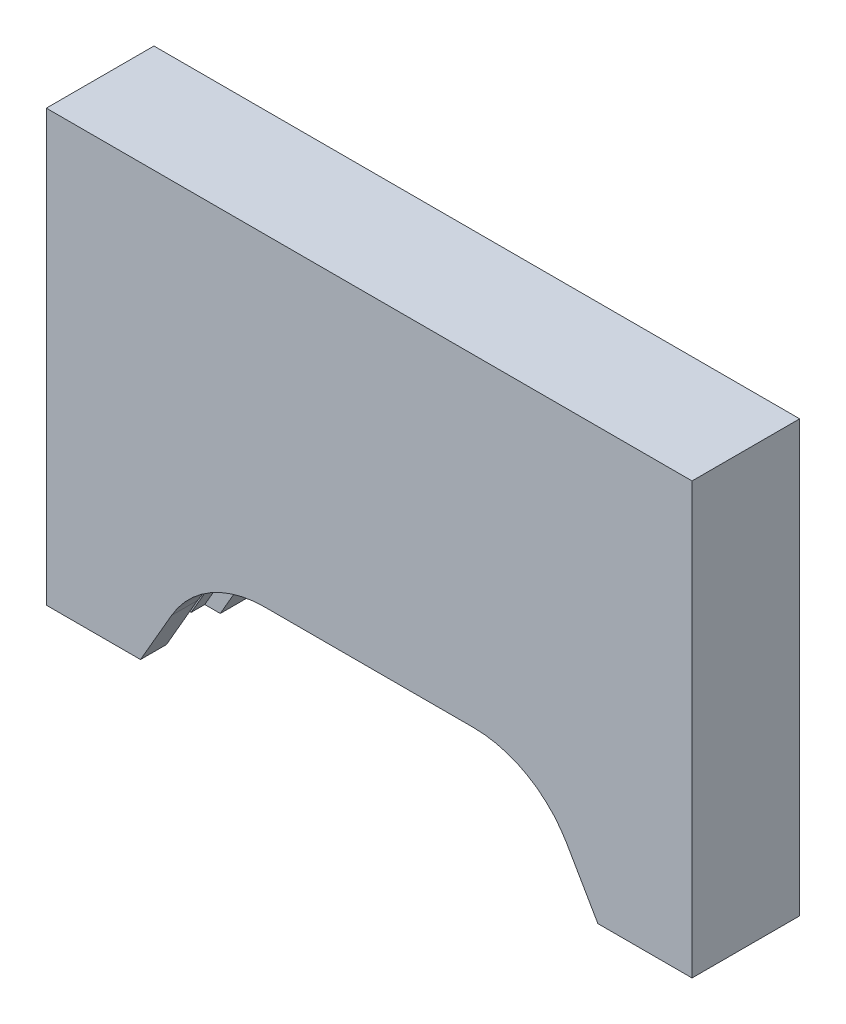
SolidWorks part; units mm, degrees
ref_plane "Front Plane" through (0, 0, 0) normal (0, 0, 1) x (1, 0, 0)
ref_plane "Top Plane" through (0, 0, 0) normal (0, 1, 0) x (1, 0, 0)
ref_plane "Right Plane" through (0, 0, 0) normal (1, 0, 0) x (0, 0, -1)
sketch "Sketch1" plane through (0, 0, 0) normal (0, 0, 1) x (1, 0, 0)
  line L1 (-76.2, -50.8) -> (76.2, -50.8)
  line L2 (-76.2, -50.8) -> (-76.2, 50.8)
  line L3 (-76.2, 50.8) -> (76.2, 50.8)
  line L4 (76.2, -50.8) -> (76.2, 50.8)
  line L5 (-76.2, -50.8) -> (76.2, 50.8) construction
  line L6 (-76.2, 50.8) -> (76.2, -50.8) construction
  point P0 (0, 0)
  dimension "D1" = 152.4
  dimension "D2" = 101.6
extrude "Boss-Extrude1" add sketch "Sketch1" along normal blind 25.4
sketch "Sketch3" plane through (0, 0, 25.4) normal (0, 0, 1) x (1, 0, 0)
  line L0 (-53.975, -50.8) -> (-46.6427, -38.1)
  line L1 (-24.6456, -25.4) -> (24.6456, -25.4)
  line L2 (46.6427, -38.1) -> (53.975, -50.8)
  line L3 (-76.2, -50.8) -> (76.2, -50.8) construction
  line L5 (0, -50.8) -> (0, 50.8) construction
  line L6 (76.2, 50.8) -> (-76.2, 50.8) construction
  arc A0 (-46.6427, -38.1) -> (-24.6456, -25.4) centre (-24.6456, -50.8) cw
  arc A1 (24.6456, -25.4) -> (46.6427, -38.1) centre (24.6456, -50.8) cw
  point P10 (0, -25.4)
  dimension "D1" = 25.4
  dimension "D2" = 60
  dimension "D3" = 60
  dimension "D4" = 25.4
  dimension "D5" = 107.95
extrude "Cut-Extrude1" cut sketch "Sketch3" against normal through all and the other way through all flip side to cut
ref_plane "Plane1" through (0, 0, 12.7) normal (0, 0, 1) x (1, 0, 0)
sketch "Sketch6" plane through (0, 0, 12.7) normal (0, 0, 1) x (1, 0, 0)
  line L2 (-76.2, -50.8) -> (-53.975, -50.8) construction
  line L3 (53.975, -50.8) -> (76.2, -50.8) construction
  line L12 (49.3923, -36.5125) -> (56.7246, -49.2125)
  line L13 (-24.6456, -22.225) -> (24.6456, -22.225)
  line L14 (-56.7246, -49.2125) -> (-49.3923, -36.5125)
  line L15 (49.3923, -36.5125) -> (64.9735, -63.5)
  line L16 (-24.6456, -22.225) -> (24.6456, -22.225)
  line L17 (-64.9735, -63.5) -> (-49.3923, -36.5125)
  arc A8 (49.3923, -36.5125) -> (24.6456, -22.225) centre (24.6456, -50.8) ccw
  arc A9 (-24.6456, -22.225) -> (-49.3923, -36.5125) centre (-24.6456, -50.8) ccw
  arc A10 (49.3923, -36.5125) -> (24.6456, -22.225) centre (24.6456, -50.8) ccw
  arc A11 (-24.6456, -22.225) -> (-49.3923, -36.5125) centre (-24.6456, -50.8) ccw
  dimension "D2" = 12.7
  dimension "D3" = 12.7
  dimension "D1" = 3.175
ref_plane "Plane2" through (-64.9735, -63.5, 12.7) normal (0.5, 0.866, 0) x (0.866, -0.5, 0)
sketch "Sketch9" plane through (-64.9735, -63.5, 12.7) normal (0.5, 0.866, 0) x (0.866, -0.5, 0)
  line L0 (0, -3.3956) -> (0, -6.5706)
  line L1 (0, -6.5706) -> (6.35, -6.5706)
  line L2 (6.35, -6.5706) -> (6.35, 6.1294)
  line L3 (6.35, 6.1294) -> (0, 6.1294)
  line L4 (0, 6.1294) -> (0, 2.9544)
  line L5 (3.175, -12.7) -> (3.175, 12.7) construction
  arc A0 (0, 2.9544) -> (0, -3.3956) centre (0, -0.2206) ccw
  dimension "D1" = 6.35
  dimension "D2" = 6.35
  dimension "D3" = 12.7
  dimension "D4" = 6.35
  dimension "D5" = 3.175
sweep "Cut-Sweep2" cut profiles "Sketch9" path "Sketch6"
